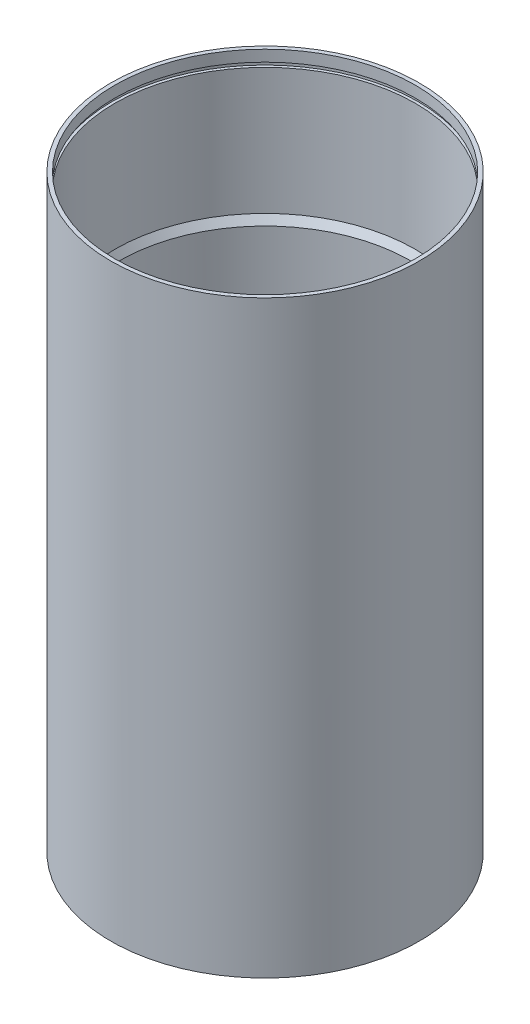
SolidWorks part; units mm, degrees
ref_plane "Płaszczyzna przednia" through (0, 0, 0) normal (0, 0, 1) x (1, 0, 0)
ref_plane "Płaszczyzna górna" through (0, 0, 0) normal (0, 1, 0) x (1, 0, 0)
ref_plane "Płaszczyzna prawa" through (0, 0, 0) normal (1, 0, 0) x (0, 0, -1)
sketch "Szkic1" plane through (0, 0, 0) normal (0, 1, 0) x (1, 0, 0)
  circle A0 centre (0, 0) radius 27.5
  circle A1 centre (0, 0) radius 26
  dimension "D1" = 55
  dimension "D2" = 1.5
extrude "Dodanie-wyciągnięcie1" add sketch "Szkic1" along normal blind 105
sketch "Szkic2" plane through (0, 0, 0) normal (0, 0, 1) x (1, 0, 0)
  line L0 (-27.5, 0) -> (27.5, 0) construction
  line L4 (7.5, 0) -> (7.5, 14.5)
  line L5 (7.5, 14.5) -> (-7.5, 14.5)
  line L6 (-7.5, 14.5) -> (-7.5, 0)
  line L7 (-7.5, 0) -> (7.5, 0)
  dimension "D1" = 14.5
  dimension "D2" = 7.5
  dimension "D3" = 15
extrude "Wytnij-wyciągnięcie1" cut sketch "Szkic2" against normal blind 100
fillet "Zaokrąglenie1" radius 1 1 edges at (7.5, 0, -25.6761)
fillet "Zaokrąglenie2" radius 1 3 edges at (-7.5, 0, -25.6761) (7.5, 14.5, -25.6761) (-7.5, 14.5, -25.6761)
sketch "Szkic3" plane through (0, 0, 0) normal (1, 0, 0) x (0, 0, -1)
  circle A0 centre (0, 3.5) radius 1.5
  dimension "D1" = 3.5
  dimension "D2" = 3
sketch "Szkic4" plane through (0, 0, 0) normal (0, 1, 0) x (1, 0, 0)
  line L1 (23, 5.1395) -> (-23, 5.1395)
  line L2 (23, 5.1395) -> (23, -5.1395)
  line L3 (23, -5.1395) -> (-23, -5.1395)
  line L4 (-23, 5.1395) -> (-23, -5.1395)
  line L5 (0, -5.1395) -> (0, 5.1395) construction
  line L6 (23, 0) -> (-23, 0) construction
  point P0 (0, 0)
  dimension "D1" = 10.2791
  dimension "D2" = 46
extrude "Wytnij-wyciągnięcie5" cut sketch "Szkic4" along normal blind 29
sketch "Szkic5" plane through (0, 105, 0) normal (0, 1, 0) x (1, 0, 0)
  circle A1 centre (0, 0) radius 26.8
  circle A2 centre (0, 0) radius 27.5 construction
  dimension "D1" = 0.7
extrude "Wytnij-wyciągnięcie6" cut sketch "Szkic5" against normal blind 25
chamfer "Sfazowanie1" distance 1 angle 60 1 edges at (0, 80, 26)
sketch "Szkic6" plane through (0, 0, 0) normal (1, 0, 0) x (0, 0, -1)
  line L0 (-26.8, 105) -> (-26.8, 103)
  line L1 (-26.8, 105) -> (-26.8, 79.6536) construction
  line L2 (-26.8, 103) -> (-27.3, 103)
  line L3 (-27.3, 103) -> (-27.3, 102.2)
  line L4 (-27.3, 102.2) -> (0, 102.2)
  line L5 (0, 102.2) -> (0, 113.386)
  line L6 (0, 113.386) -> (-26.8, 105)
  dimension "D1" = 0.5
  dimension "D2" = 2
  dimension "D3" = 0.8
revolve "Wycięcie-obrót1" cut sketch "Szkic6" angle 360 about L5
